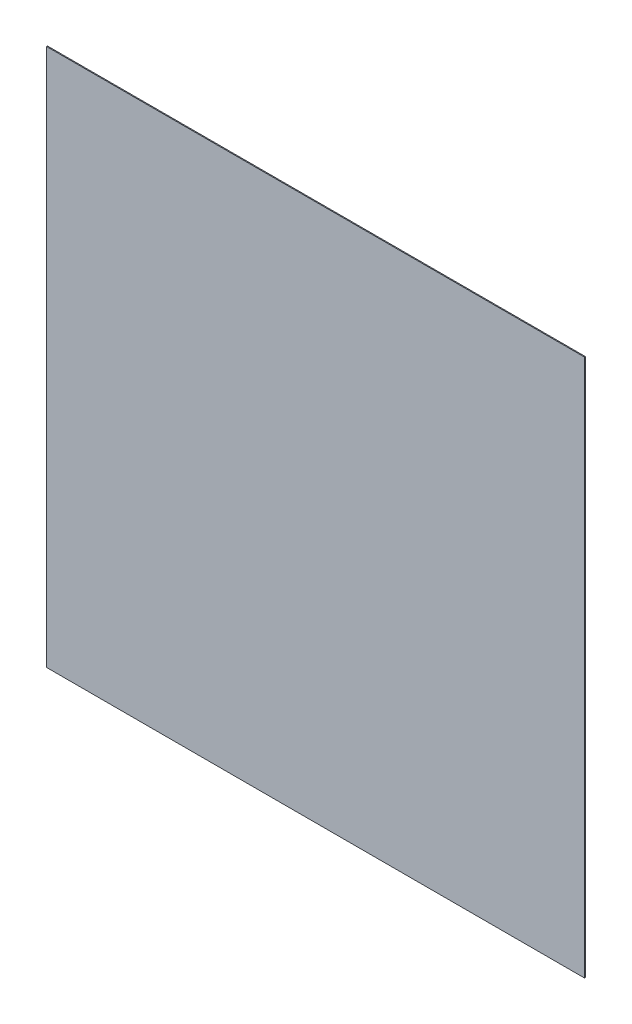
SolidWorks part; units mm, degrees
ref_plane "Front Plane" through (0, 0, 0) normal (0, 0, 1) x (1, 0, 0)
ref_plane "Top Plane" through (0, 0, 0) normal (0, 1, 0) x (1, 0, 0)
ref_plane "Right Plane" through (0, 0, 0) normal (1, 0, 0) x (0, 0, -1)
sketch "Sketch1" plane through (0, 0, 0) normal (0, 0, 1) x (1, 0, 0)
  line L0 (-1828.8, 1828.8) -> (1828.8, -1828.8) construction
  line L1 (-1828.8, 1828.8) -> (1828.8, 1828.8)
  line L2 (-1828.8, 1828.8) -> (-1828.8, -1828.8)
  line L3 (-1828.8, -1828.8) -> (1828.8, -1828.8)
  line L4 (1828.8, 1828.8) -> (1828.8, -1828.8)
  point P4 (0, 0)
  dimension "D1" = 3657.6
  dimension "D2" = 3657.6
extrude "Extrude1" add sketch "Sketch1" against normal blind 6.35
